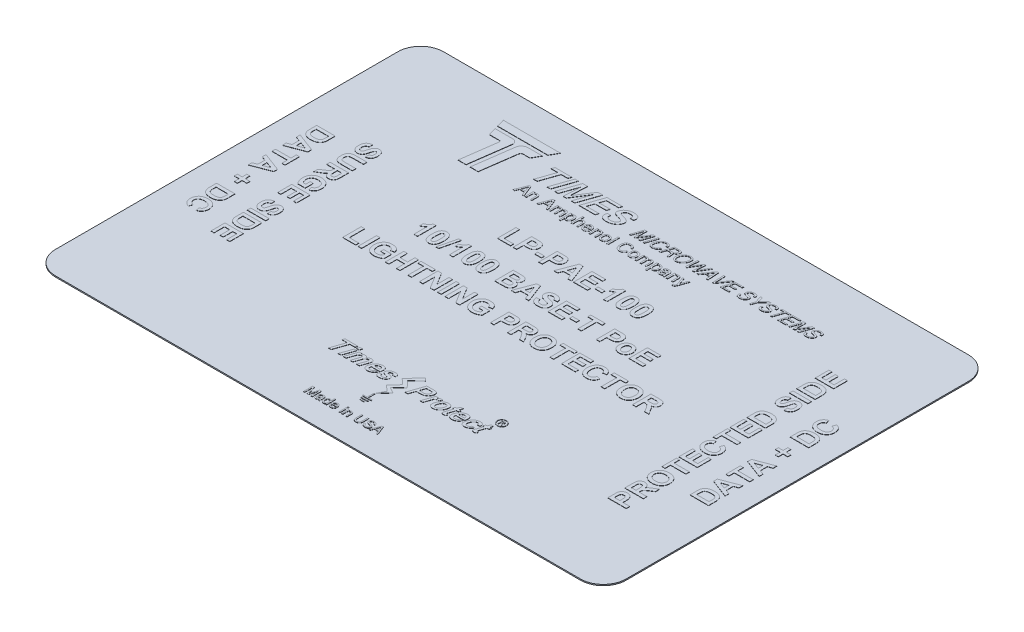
SolidWorks part; units mm, degrees
ref_plane "Front Plane" through (0, 0, 0) normal (0, 0, 1) x (1, 0, 0)
ref_plane "Top Plane" through (0, 0, 0) normal (0, 1, 0) x (1, 0, 0)
ref_plane "Right Plane" through (0, 0, 0) normal (1, 0, 0) x (0, 0, -1)
sketch "Sketch1" plane through (0, 0, 0) normal (0, 1, 0) x (1, 0, 0)
  line L1 (-29.21, 21.59) -> (29.21, 21.59)
  line L2 (-31.75, 19.05) -> (-31.75, -19.05)
  line L3 (-29.21, -21.59) -> (29.21, -21.59)
  line L4 (31.75, 19.05) -> (31.75, -19.05)
  line L5 (-31.75, 21.59) -> (31.75, -21.59) construction
  line L6 (-31.75, -21.59) -> (31.75, 21.59) construction
  arc A0 (-31.75, -19.05) -> (-29.21, -21.59) centre (-29.21, -19.05) ccw
  arc A1 (29.21, -21.59) -> (31.75, -19.05) centre (29.21, -19.05) ccw
  arc A2 (29.21, 21.59) -> (31.75, 19.05) centre (29.21, 19.05) cw
  arc A3 (-29.21, 21.59) -> (-31.75, 19.05) centre (-29.21, 19.05) ccw
  point P0 (0, 0)
  dimension "D1" = 2.54
extrude "Label" add sketch "Sketch1" along normal blind 0.127
sketch "Sketch2" plane through (0, 0.127, 0) normal (0, 1, 0) x (1, 0, 0)
  line L0 (-19.2622, 18.2941) -> (-12.9122, 18.2941)
  line L1 (-19.2622, 18.2941) -> (-19.0082, 17.4051)
  line L2 (-16.0872, 17.4051) -> (-13.4202, 17.4051)
  line L3 (-16.0872, 17.4051) -> (-19.0082, 17.4051)
  line L4 (-12.9122, 18.2941) -> (-13.4202, 17.4051)
  line L5 (-17.9451, 11.9441) -> (-17.0561, 11.9441)
  line L6 (-17.0561, 11.9441) -> (-16.4355, 16.4467)
  line L7 (-15.2324, 17.0235) -> (-13.6369, 17.0235)
  line L8 (-16.9387, 17.0241) -> (-18.8994, 17.0241)
  line L9 (-17.9451, 11.9441) -> (-17.3873, 15.9908)
  line L10 (-18.8994, 17.0241) -> (-18.6454, 16.1351)
  line L11 (-17.5131, 16.1351) -> (-18.6454, 16.1351)
  line L12 (-15.713, 11.9444) -> (-15.1607, 15.9161)
  line L13 (-16.602, 11.9444) -> (-15.713, 11.9444)
  line L14 (-16.602, 11.9444) -> (-15.9871, 16.3665)
  line L15 (-14.1446, 16.1351) -> (-14.9091, 16.1351)
  line L17 (-13.6369, 17.0235) -> (-14.1446, 16.1351)
  arc A0 (-16.4355, 16.4467) -> (-16.9387, 17.0241) centre (-16.9387, 16.5161) ccw
  arc A1 (-17.3873, 15.9908) -> (-17.5131, 16.1351) centre (-17.5131, 16.0081) ccw
  arc A2 (-15.1607, 15.9161) -> (-14.9091, 16.1351) centre (-14.9091, 15.8811) cw
  arc A3 (-15.2324, 17.0235) -> (-15.9871, 16.3665) centre (-15.2324, 16.2615) ccw
  dimension "D1" = 0.508
  dimension "D2" = 0.127
  dimension "D3" = 0.254
  dimension "D4" = 0.762
extrude "Logo Graphic" add sketch "Sketch2" along normal blind 0.0254 separate body
sketch "Sketch3" plane through (0, 0.127, 0) normal (0, 1, 0) x (1, 0, 0)
  text T0 "<b><i>TIMES</i></b>" font "Microsoft Sans Serif" height in points 9
  text T1 "<i>MICROWAVE SYSTEMS</i>" font "Microsoft Sans Serif" height in points 5
extrude "Times Microwave System" add sketch "Sketch3" along normal blind 0.0254 separate body
sketch "Sketch4" plane through (0, 0.127, 0) normal (0, 1, 0) x (1, 0, 0)
  line L0 (1.27, -10.8671) -> (1.5414, -11.1615)
  line L1 (1.5414, -11.1615) -> (0.5063, -12.1159)
  line L2 (0.2023, -13.7399) -> (1.1759, -12.8421)
  line L3 (0.8676, -14.1191) -> (0.2023, -13.7399)
  line L4 (1.1759, -12.8421) -> (0.5063, -12.1159)
  line L5 (0.8676, -14.1191) -> (-0.0907, -15.1971)
  line L6 (0.2023, -14.1191) -> (0.3884, -14.2845)
  line L7 (0.2023, -14.1191) -> (-0.2243, -13.7399)
  line L8 (-0.2243, -13.7399) -> (0.6289, -12.78)
  line L9 (0.6289, -12.78) -> (-0.011, -12.2112)
  line L10 (-0.011, -12.2112) -> (1.27, -10.8671)
  line L11 (0.3884, -14.2845) -> (-0.0907, -15.1971)
extrude "Lightning Bolt Graphic" add sketch "Sketch4" along normal blind 0.0254 separate body
sketch "Sketch5" plane through (0, 0.127, 0) normal (0, 1, 0) x (1, 0, 0)
  text T0 "<i>Times   Protect</i>" font "Microsoft Sans Serif" height in points 7
extrude "Times Protect" add sketch "Sketch5" along normal blind 0.0254 separate body
sketch "Sketch6" plane through (0, 0.127, 0) normal (0, 1, 0) x (1, 0, 0)
  line L0 (-0.5479, -15.9591) -> (-0.1542, -15.9591)
  line L1 (-0.1034, -15.1971) -> (-0.078, -15.1971)
  line L2 (-0.1542, -15.2479) -> (-0.1542, -15.9591)
  line L3 (-0.0272, -15.9591) -> (0.3665, -15.9591)
  line L4 (-0.0272, -15.2479) -> (-0.0272, -15.9591)
  line L7 (0.4173, -16.0099) -> (0.4173, -16.0353)
  line L8 (0.3665, -16.0861) -> (-0.5479, -16.0861)
  line L9 (-0.5987, -16.0353) -> (-0.5987, -16.0099)
  line L12 (-0.0907, -16.2131) -> (0.2395, -16.2131)
  line L13 (-0.0907, -16.2131) -> (-0.4209, -16.2131)
  line L14 (-0.4717, -16.2639) -> (-0.4717, -16.2893)
  line L15 (-0.4209, -16.3401) -> (0.2395, -16.3401)
  line L16 (0.2903, -16.2893) -> (0.2903, -16.2639)
  line L18 (-0.0907, -16.4671) -> (0.1125, -16.4671)
  line L19 (0.1633, -16.5179) -> (0.1633, -16.5433)
  line L20 (0.1125, -16.5941) -> (-0.2939, -16.5941)
  line L21 (-0.3447, -16.5433) -> (-0.3447, -16.5179)
  line L22 (-0.2939, -16.4671) -> (-0.0907, -16.4671)
  arc A0 (0.3665, -16.0861) -> (0.4173, -16.0353) centre (0.3665, -16.0353) ccw
  arc A1 (0.4173, -16.0099) -> (0.3665, -15.9591) centre (0.3665, -16.0099) ccw
  arc A2 (-0.5479, -16.0861) -> (-0.5987, -16.0353) centre (-0.5479, -16.0353) cw
  arc A3 (-0.5479, -15.9591) -> (-0.5987, -16.0099) centre (-0.5479, -16.0099) ccw
  arc A4 (0.2395, -16.2131) -> (0.2903, -16.2639) centre (0.2395, -16.2639) cw
  arc A5 (0.2903, -16.2893) -> (0.2395, -16.3401) centre (0.2395, -16.2893) cw
  arc A6 (-0.4209, -16.3401) -> (-0.4717, -16.2893) centre (-0.4209, -16.2893) cw
  arc A7 (-0.4717, -16.2639) -> (-0.4209, -16.2131) centre (-0.4209, -16.2639) cw
  arc A8 (0.1125, -16.4671) -> (0.1633, -16.5179) centre (0.1125, -16.5179) cw
  arc A9 (0.1633, -16.5433) -> (0.1125, -16.5941) centre (0.1125, -16.5433) cw
  arc A10 (-0.2939, -16.5941) -> (-0.3447, -16.5433) centre (-0.2939, -16.5433) cw
  arc A11 (-0.3447, -16.5179) -> (-0.2939, -16.4671) centre (-0.2939, -16.5179) cw
  arc A12 (-0.1542, -15.2479) -> (-0.1034, -15.1971) centre (-0.1034, -15.2479) cw
  arc A13 (-0.078, -15.1971) -> (-0.0272, -15.2479) centre (-0.078, -15.2479) cw
  dimension "D1" = 0.0508
  dimension "D2" = 0.0508
  dimension "D3" = 0.0508
  dimension "D4" = 0.0508
extrude "Ground Graphic" add sketch "Sketch6" along normal blind 0.0254 separate body
sketch "Sketch7" plane through (0, 0.127, 0) normal (0, 1, 0) x (1, 0, 0)
  circle A0 centre (9.8381, -10.9643) radius 0.508
extrude "Trademark Circle" add sketch "Sketch7" along normal blind 0.0254
sketch "Sketch8" plane through (0, 0.1524, 0) normal (0, 1, 0) x (1, 0, 0)
  circle A0 centre (9.8381, -10.9643) radius 0.4572
extrude "Trademark" cut sketch "Sketch8" against normal blind 0.0254
sketch "Sketch9" plane through (0, 0.127, 0) normal (0, 1, 0) x (1, 0, 0)
  text T0 "R" font "Arial" height 0.508
extrude "Trademark R" add sketch "Sketch9" along normal blind 0.0254
sketch "Sketch10" plane through (0, 0.127, 0) normal (0, 1, 0) x (1, 0, 0)
  text T0 "Made in USA" font "Arial" height in points 4
extrude "Made in USA" add sketch "Sketch10" along normal blind 0.0254
sketch "Sketch15" plane through (0, 0.127, 0) normal (0, 1, 0) x (1, 0, 0)
  line L0 (-29.21, -21.59) -> (29.21, -21.59) construction
  line L2 (-24.8499, 21.59) -> (-24.8499, -21.59) construction
  line L4 (29.21, 21.59) -> (-29.21, 21.59) construction
  line L6 (-29.21, -21.59) -> (29.21, -21.59) construction
  text T0 "<b>SURGE SIDE</b>  DATA + DC" font "Arial" height in points 8
extrude "Surge" add sketch "Sketch15" along normal blind 0.0254
sketch "Sketch16" plane through (0, 0.127, 0) normal (0, 1, 0) x (1, 0, 0)
  line L0 (-29.21, -21.59) -> (29.21, -21.59) construction
  line L2 (24.9856, 21.59) -> (24.9856, -21.59) construction
  line L3 (29.21, 21.59) -> (-29.21, 21.59) construction
  line L4 (-29.21, -21.59) -> (29.21, -21.59) construction
  text T0 "<b>PROTECTED SIDE</b>  DATA + DC" font "Arial" height in points 8
extrude "Protected" add sketch "Sketch16" along normal blind 0.0254
sketch "Sketch17" [suppressed] plane through (0, 0.127, 0) normal (0, 1, 0) x (1, 0, 0)
  line L0 (0, -21.59) -> (0, 21.59) construction
  line L1 (-29.21, -21.59) -> (29.21, -21.59) construction
  line L2 (29.21, 21.59) -> (-29.21, 21.59) construction
  line L3 (-31.75, 0) -> (31.75, 0) construction
  line L4 (-31.75, 19.05) -> (-31.75, -19.05) construction
  line L5 (31.75, -19.05) -> (31.75, 19.05) construction
sketch "Sketch18" plane through (0, 0.127, 0) normal (0, 1, 0) x (1, 0, 0)
  text T0 "           LP-PAE-100      10/100 BASE-T PoE  LIGHTNING PROTECTOR" font "Arial" height in points 8
extrude "Description" add sketch "Sketch18" along normal blind 0.0254
sketch "Sketch19" plane through (0, 0.127, 0) normal (0, 1, 0) x (1, 0, 0)
  text T0 "An Amphenol Company" font "Arial" height in points 5
extrude "An Amphenol Company" add sketch "Sketch19" along normal blind 0.0254 separate body
